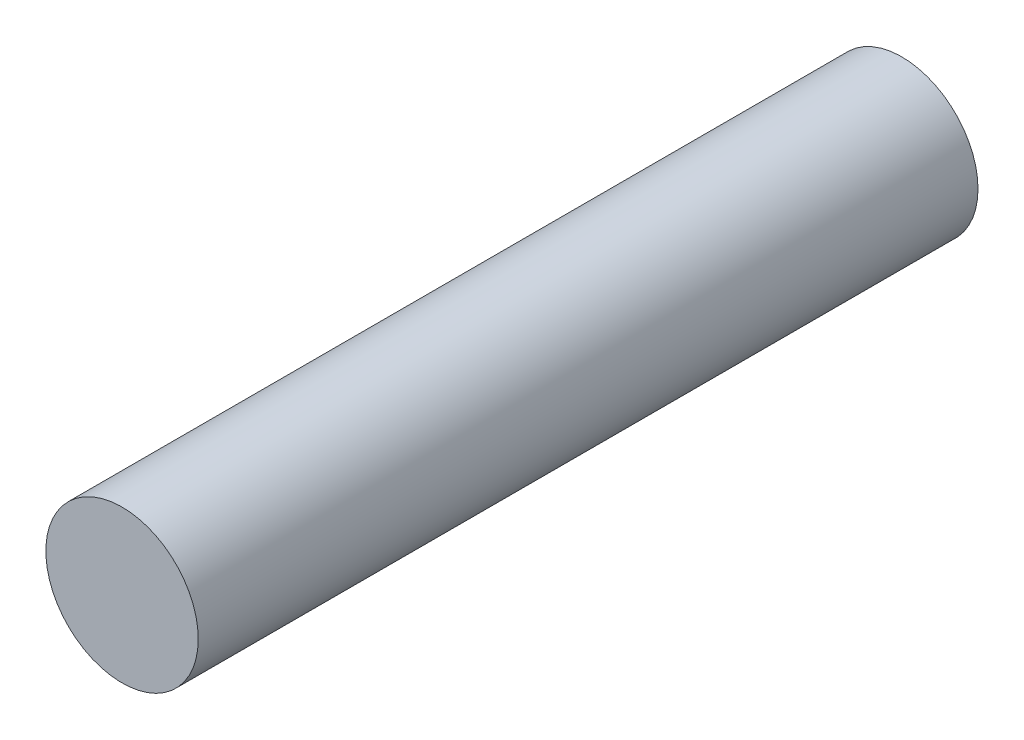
SolidWorks part; units mm, degrees
ref_plane "Front Plane" through (0, 0, 0) normal (0, 0, 1) x (1, 0, 0)
ref_plane "Top Plane" through (0, 0, 0) normal (0, 1, 0) x (1, 0, 0)
ref_plane "Right Plane" through (0, 0, 0) normal (1, 0, 0) x (0, 0, -1)
sketch "Sketch1" plane through (0, 0, 0) normal (0, 0, 1) x (1, 0, 0)
  circle A0 centre (0, 0) radius 3
extrude "Boss-Extrude1" add sketch "Sketch1" along normal blind 30.7 contours A0
equation "\"ShaftDiameter\"= 12mm"
equation "\"PendulumDiameter\"=12mm"
equation "\"EncoderShaftDiameter\"= 6mm"
equation "\"D1@Sketch1\"=\"EncoderShaftDiameter\""
equation "\"EncoderShaftLength\"=15mm+.5in+3mm"
equation "\"D1@Boss-Extrude1\"=\"EncoderShaftLength\""
